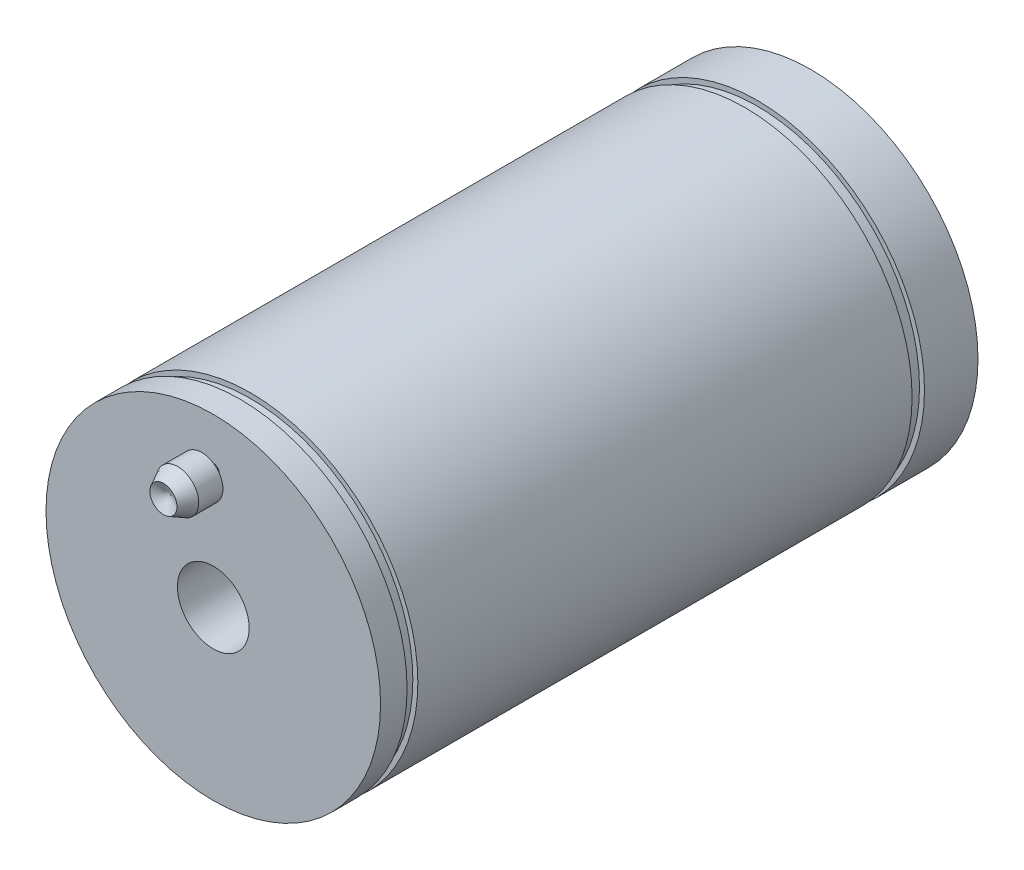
SolidWorks part; units mm, degrees
ref_plane "Front Plane" through (0, 0, 0) normal (0, 0, 1) x (1, 0, 0)
ref_plane "Top Plane" through (0, 0, 0) normal (0, 1, 0) x (1, 0, 0)
ref_plane "Right Plane" through (0, 0, 0) normal (1, 0, 0) x (0, 0, -1)
sketch "Sketch1" plane through (0, 0, 0) normal (0, 0, 1) x (1, 0, 0)
  circle A0 centre (0, 0) radius 70
extrude "Boss-Extrude1" add sketch "Sketch1" against normal blind 250
sketch "Sketch2" plane through (0, 0, 0) normal (1, 0, 0) x (0, 0, -1)
  line L0 (-46.5476, 0) -> (289.3635, 0) construction
  line L1 (11.0893, 71.4111) -> (15.5977, 71.4111)
  line L2 (11.0893, 71.4111) -> (11.0893, 67.9132)
  line L3 (11.0893, 67.9132) -> (15.5977, 67.9132)
  line L4 (15.5977, 71.4111) -> (15.5977, 67.9132)
  line L5 (222.4221, 71.4111) -> (227.6063, 71.4111)
  line L6 (222.4221, 71.4111) -> (222.4221, 67.9132)
  line L7 (222.4221, 67.9132) -> (227.6063, 67.9132)
  line L8 (227.6063, 71.4111) -> (227.6063, 67.9132)
revolve "Cut-Revolve1" cut sketch "Sketch2" angle 360 about L0
sketch "Sketch3" plane through (0, 0, 0) normal (1, 0, 0) x (0, 0, -1)
  line L0 (0, 52.2949) -> (-4.7687, 52.2949)
  line L1 (0, 70) -> (0, -70) construction
  line L2 (-4.7687, 52.2949) -> (-4.7687, 58.5524)
  line L3 (-4.7687, 58.5524) -> (-14.8999, 58.5524)
  line L4 (-14.8999, 58.5524) -> (-20.8594, 55.4236)
  line L5 (-20.8594, 55.4236) -> (-17.8797, 49.7479)
  line L6 (-17.8797, 49.7479) -> (0, 49.7479)
  line L7 (0, 49.7479) -> (0, 52.2949)
revolve "Revolve2" add sketch "Sketch3" angle 360 about L6
sketch "Sketch4" plane through (0, 0, 0) normal (0, 0, 1) x (1, 0, 0)
  circle A0 centre (0, 0) radius 15
extrude "Cut-Extrude1" cut sketch "Sketch4" along normal blind 47 and the other way blind 265
